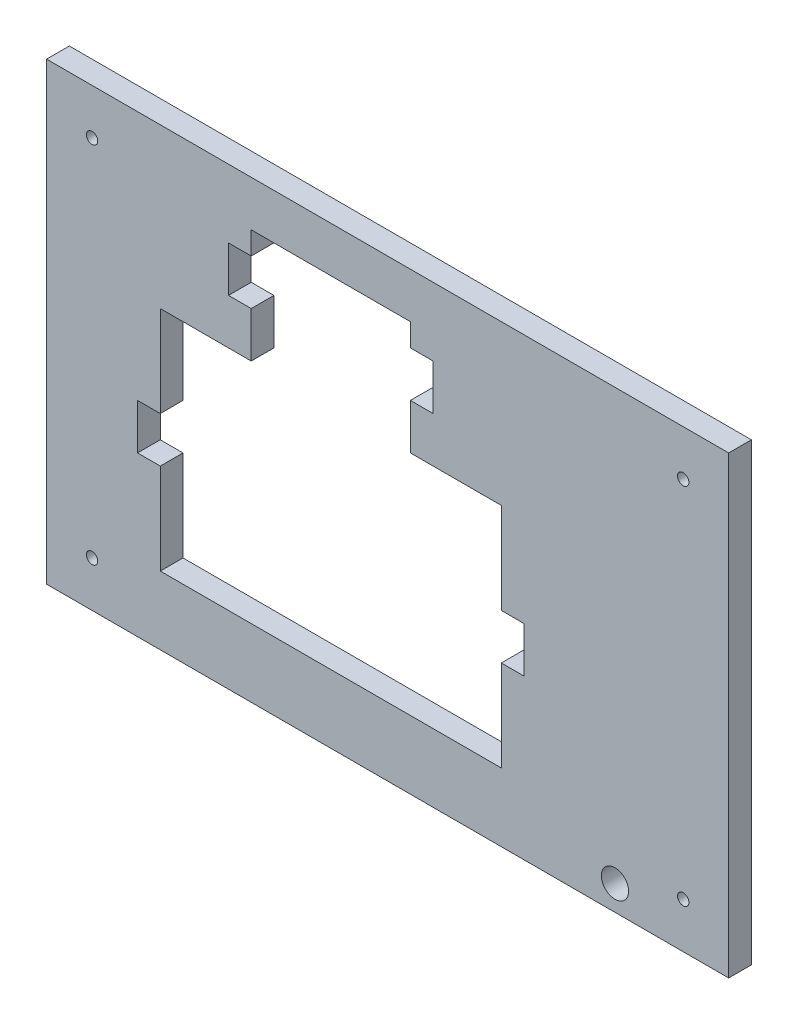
SolidWorks part; units mm, degrees
ref_plane "Plan de face" through (0, 0, 0) normal (0, 0, 1) x (1, 0, 0)
ref_plane "Plan de dessus" through (0, 0, 0) normal (0, 1, 0) x (1, 0, 0)
ref_plane "Plan de droite" through (0, 0, 0) normal (1, 0, 0) x (0, 0, -1)
sketch "Esquisse1" plane through (0, 0, 0) normal (0, 0, 1) x (1, 0, 0)
  line L1 (0, 0) -> (300, 0)
  line L2 (0, 0) -> (0, 200)
  line L3 (0, 200) -> (300, 200)
  line L4 (300, 0) -> (300, 200)
  dimension "D1" = 300
  dimension "D2" = 200
extrude "Extrusion1" add sketch "Esquisse1" against normal blind 10
sketch "Esquisse2" plane through (0, 0, 0) normal (0, 0, 1) x (1, 0, 0)
  line L0 (125, 213.5042) -> (125, -13.5042) construction
  line L1 (300, 0) -> (300, 200) construction
  line L2 (50, 30) -> (200, 30)
  line L3 (0, 0) -> (300, 0) construction
  line L4 (200, 30) -> (200, 70)
  line L5 (200, 70) -> (210, 70)
  line L6 (210, 70) -> (210, 90)
  line L7 (210, 90) -> (200, 90)
  line L8 (200, 90) -> (200, 130)
  line L9 (200, 130) -> (160, 130)
  line L10 (160, 130) -> (160, 150)
  line L11 (160, 150) -> (170, 150)
  line L12 (170, 150) -> (170, 170)
  line L13 (170, 170) -> (160, 170)
  line L14 (160, 170) -> (160, 180)
  line L15 (160, 180) -> (90, 180)
  line L18 (90, 170) -> (90, 180)
  line L19 (80, 170) -> (90, 170)
  line L20 (80, 150) -> (80, 170)
  line L21 (90, 150) -> (80, 150)
  line L22 (90, 130) -> (90, 150)
  line L23 (50, 130) -> (90, 130)
  line L24 (50, 90) -> (50, 130)
  line L25 (40, 90) -> (50, 90)
  line L26 (40, 70) -> (40, 90)
  line L27 (50, 70) -> (40, 70)
  line L28 (50, 30) -> (50, 70)
  point P21 (125, 180)
  point P32 (125, 30)
  dimension "D1" = 175
  dimension "D2" = 30
  dimension "D3" = 75
  dimension "D4" = 40
  dimension "D5" = 10
  dimension "D6" = 20
  dimension "D7" = 40
  dimension "D8" = 20
  dimension "D9" = 10
  dimension "D10" = 20
  dimension "D11" = 35
  dimension "D12" = 10
extrude "Enlèv. mat.-Extru.1" cut sketch "Esquisse2" against normal through all
sketch "Esquisse3" plane through (0, 0, -10) normal (0, 0, -1) x (-1, 0, 0)
  line L0 (-300, 0) -> (-300, 200) construction
  line L1 (-300, 200) -> (0, 200) construction
  circle A0 centre (-280, 180) radius 5
  dimension "D3" = 10
  dimension "D1" = 20
  dimension "D2" = 20
extrude "Enlèv. mat.-Extru.2" cut sketch "Esquisse3" against normal blind 5
sketch "Esquisse4" plane through (0, 0, -5) normal (0, 0, -1) x (-1, 0, 0)
  circle A0 centre (-280, 180) radius 2.5
  circle A1 centre (-280, 180) radius 5 construction
  dimension "D1" = 5
extrude "Enlèv. mat.-Extru.3" cut sketch "Esquisse4" against normal through all
pattern_linear "Répétition linéaire1" count 2 spacing 260 along (-1, 0, 0) count 2 spacing 160 along (0, -1, 0) of "Enlèv. mat.-Extru.3", "Enlèv. mat.-Extru.2"
sketch "Esquisse5" plane through (0, 0, -10) normal (0, 0, -1) x (-1, 0, 0)
  line L0 (-300, 0) -> (-300, 200) construction
  line L1 (0, 0) -> (-300, 0) construction
  circle A0 centre (-250, 11) radius 6
  dimension "D3" = 12
  dimension "D1" = 50
  dimension "D2" = 11
extrude "Enlèv. mat.-Extru.4" cut sketch "Esquisse5" against normal through all
